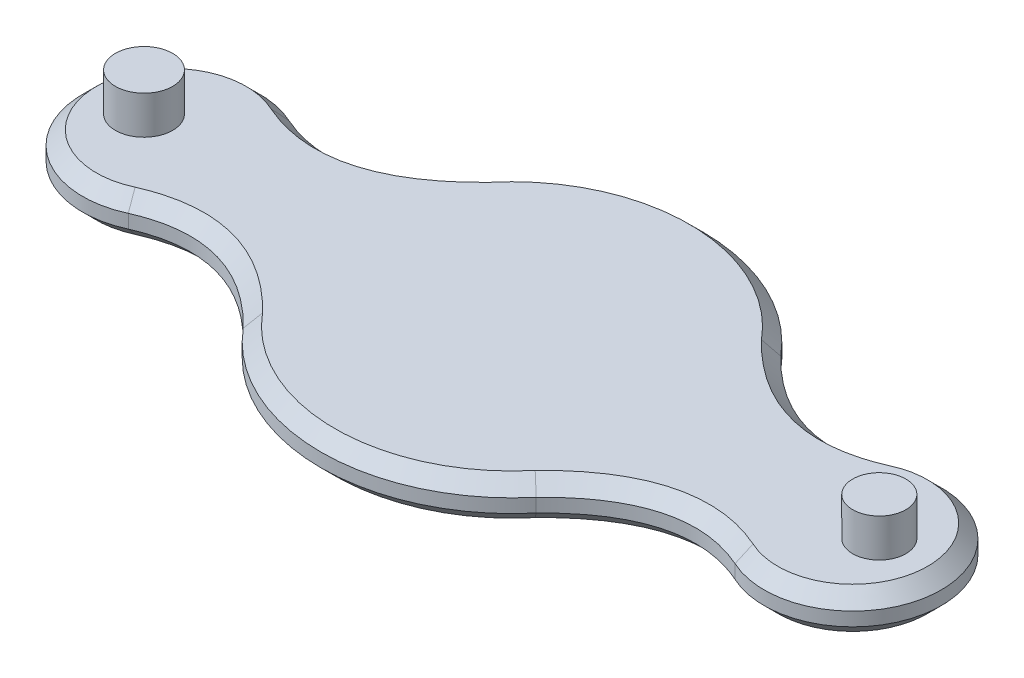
SolidWorks part; units mm, degrees
ref_plane "前视基准面" through (0, 0, 0) normal (0, 0, 1) x (1, 0, 0)
ref_plane "上视基准面" through (0, 0, 0) normal (0, 1, 0) x (1, 0, 0)
ref_plane "右视基准面" through (0, 0, 0) normal (1, 0, 0) x (0, 0, -1)
other "Configuration Table"
sketch "草图1" plane through (0, 0, 0) normal (0, 1, 0) x (1, 0, 0)
  arc A0 (-10.748, -8.9711) -> (10.748, -8.9711) centre (0, 0) ccw
  circle A1 centre (26.95, 0) radius 1.95
  arc A2 (22.2596, -5.8941) -> (22.2596, 5.8941) centre (25, 0) ccw
  arc A3 (-22.2596, -5.8941) -> (-22.2596, 5.8941) centre (-25, 0) cw
  arc A4 (10.748, 8.9711) -> (-10.748, 8.9711) centre (0, 0) ccw
  circle A5 centre (-27, 0) radius 1.95
  circle A6 centre (0, 0) radius 3.4
  spline S0 degree 2 poles (10.748, 8.9711) (16.2862, 3.258) (22.2596, 5.8941) knots 0 0 0 1 1 1
  spline S1 degree 2 poles (10.748, -8.9711) (16.2862, -3.258) (22.2596, -5.8941) knots 0 0 0 1 1 1
  spline S2 degree 2 poles (-10.748, -8.9711) (-16.2862, -3.258) (-22.2596, -5.8941) knots 0 0 0 1 1 1
  spline S3 degree 2 poles (-10.748, 8.9711) (-16.2862, 3.258) (-22.2596, 5.8941) knots 0 0 0 1 1 1
extrude "凸台-拉伸1" add sketch "草图1" along normal blind 3
sketch "草图2" plane through (0, 0, 0) normal (0, -1, 0) x (1, 0, 0)
  circle A0 centre (-27, 0) radius 2.1
  circle A1 centre (26.95, 0) radius 1.95
extrude "凸台-拉伸3" add sketch "草图2" against normal blind 5.8
chamfer "倒角1" distance 1 angle 45 16 edges at (0, 0, 14) (0, 3, 14) (-31.5, 0, 0) (-31.5, 3, 0) (0, 0, -14) (0, 3, -14) (31.5, 0, 0) (31.5, 3, 0)
sketch "草图4" plane through (0, 3, 0) normal (0, 1, 0) x (1, 0, 0)
  circle A0 centre (0, 0) radius 3.4
extrude "凸台-拉伸4" add sketch "草图4" against normal blind 3
sketch "草图6" plane through (0, 0, 0) normal (0, -1, 0) x (1, 0, 0)
  circle A0 centre (0, 0) radius 3.25
extrude "凸台-拉伸5" add sketch "草图6" along normal blind 6.6
sketch "草图7" plane through (0, -6.6, 0) normal (0, -1, 0) x (1, 0, 0)
  circle A0 centre (0, 0) radius 1.1
extrude "切除-拉伸3" cut sketch "草图7" against normal blind 5
